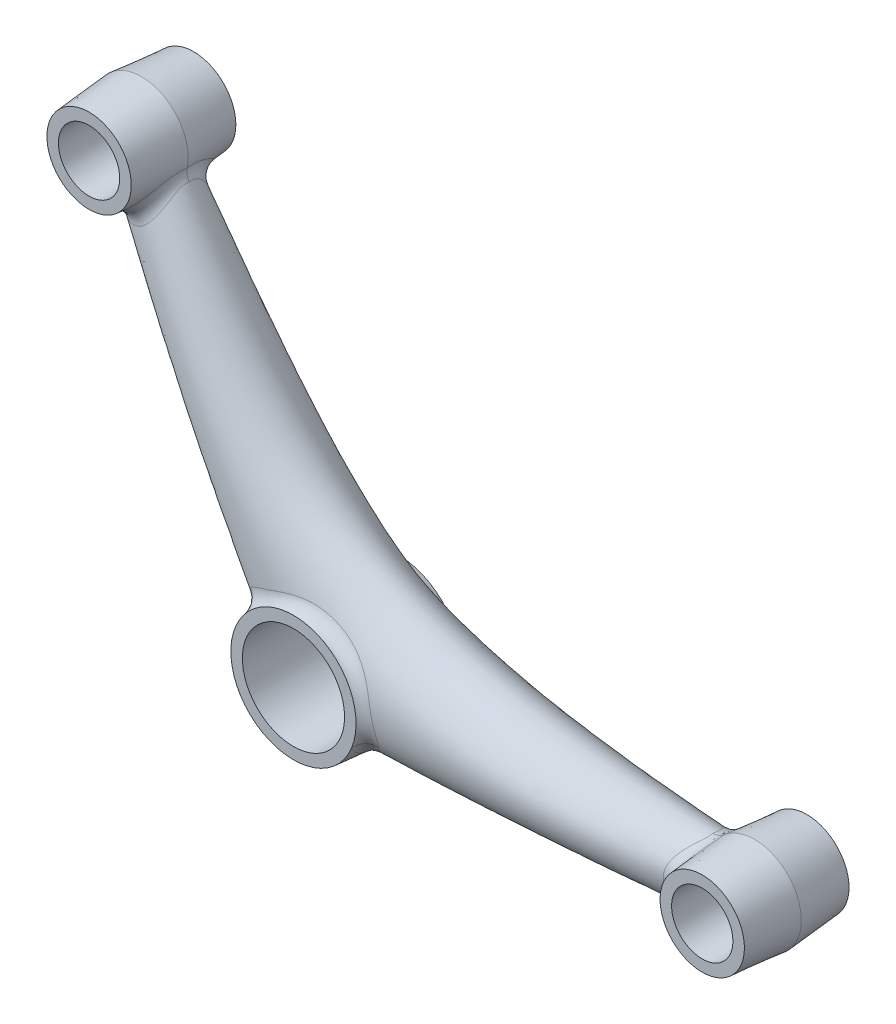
SolidWorks part; units mm, degrees
ref_plane "Front Plane" through (0, 0, 0) normal (0, 0, 1) x (1, 0, 0)
ref_plane "Top Plane" through (0, 0, 0) normal (0, 1, 0) x (1, 0, 0)
ref_plane "Right Plane" through (0, 0, 0) normal (1, 0, 0) x (0, 0, -1)
sketch "Layout Sketch" plane through (0, 0, 0) normal (0, 0, 1) x (1, 0, 0)
  line L0 (-127, 219.9705) -> (0, 0) construction
  line L1 (0, 0) -> (254, 0) construction
  line L2 (254, 19.05) -> (254, -19.05) construction
  line L3 (-143.4978, 210.4455) -> (-110.5022, 229.4955) construction
  line L4 (0, 0) -> (32.5, 56.2917) construction
  circle A0 centre (0, 0) radius 31.75
  circle A1 centre (-127, 219.9705) radius 19.05
  circle A2 centre (254, 0) radius 19.05
  dimension "D1" = 63.5
  dimension "D3" = 38.1
  dimension "D2" = 254
  dimension "D4" = 65
  dimension "D5" = 120
sketch "Guides" plane through (0, 0, 0) normal (0, 0, 1) x (1, 0, 0)
  line L2 (254, 19.05) -> (254, -19.05) construction
  line L4 (-143.4978, 210.4455) -> (-110.5022, 229.4955) construction
  line L5 (-143.4978, 210.4455) -> (-28.257, -14.4777)
  line L6 (1.5905, -31.7101) -> (254, -19.05)
  arc A0 (-28.257, -14.4777) -> (1.5905, -31.7101) centre (0, 0) ccw
  circle A1 centre (0, 0) radius 31.75 construction
  spline S0 degree 3 poles (-110.5022, 229.4955) (-61.8865, 145.2906) (12.7023, 30.413) (166.4818, 19.05) (254, 19.05) knots 0 0 0 0 0.5 1 1 1 1
ref_plane "Plane1" through (254, 0, 0) normal (1, 0, 0) x (0, 0, -1)
ref_plane "Plane2" through (-127, 219.9705, 0) normal (0.5, -0.866, 0) x (-0.866, -0.5, 0)
ref_plane "Plane3" through (0, 0, 0) normal (0.866, -0.5, 0) x (0.5, 0.866, 0)
sketch "Sketch3" plane through (254, 0, 0) normal (1, 0, 0) x (0, 0, -1)
  ellipse E0 centre (0, 0) end of major axis (0, -19.05) minor radius 15
  dimension "D1" = 30
sketch "Sketch4" plane through (-127, 219.9705, 0) normal (0.5, -0.866, 0) x (0, 0, -1)
  ellipse E0 centre (0, 0) end of major axis (0, -19.05) minor radius 15
sketch "Sketch5" plane through (0, 0, 0) normal (0.866, -0.5, 0) x (0.5, 0.866, 0)
  ellipse E0 centre (16.625, 0) end of major axis (65, 0) minor radius 30
  dimension "D1" = 60
other "Boundary1"
sketch "Sketch6" plane through (0, 0, 0) normal (0, 0, 1) x (1, 0, 0)
  circle A13 centre (-127, 219.9705) radius 29.05
  circle A14 centre (-127, 219.9705) radius 29.05
  circle A16 centre (0, 0) radius 41.75
  circle A17 centre (0, 0) radius 41.75
  circle A19 centre (254, 0) radius 29.05
  circle A20 centre (254, 0) radius 29.05
extrude "Boss-Extrude1" add sketch "Sketch6" along normal mid plane 65 draft 5
sketch "Sketch7" plane through (0, 0, 0) normal (0, 0, 1) x (1, 0, 0)
  circle A0 centre (254, 0) radius 19.05 construction
  circle A1 centre (0, 0) radius 31.75 construction
  circle A2 centre (-127, 219.9705) radius 19.05 construction
  circle A3 centre (254, 0) radius 19.05
  circle A4 centre (0, 0) radius 31.75
  circle A5 centre (-127, 219.9705) radius 19.05
extrude "Cut-Extrude1" cut sketch "Sketch7" against normal through all both and the other way through all
fillet "Fillet1" radius 10 6 edges at (226.5436, 0.8569, 18.0625) (226.5436, 0.8569, -18.0625) (-115.0587, 195.2321, 18.0632) (-115.0587, 195.2321, -18.0632) (24.5768, 30.8121, 26.7086) (24.5768, 30.8121, -26.7086)
equation "\"offset\"=10"
equation "\"D1@Sketch6\"=\"offset\""
equation "\"D2@Sketch6\"=\"offset\""
equation "\"D3@Sketch6\"=\"offset\""
